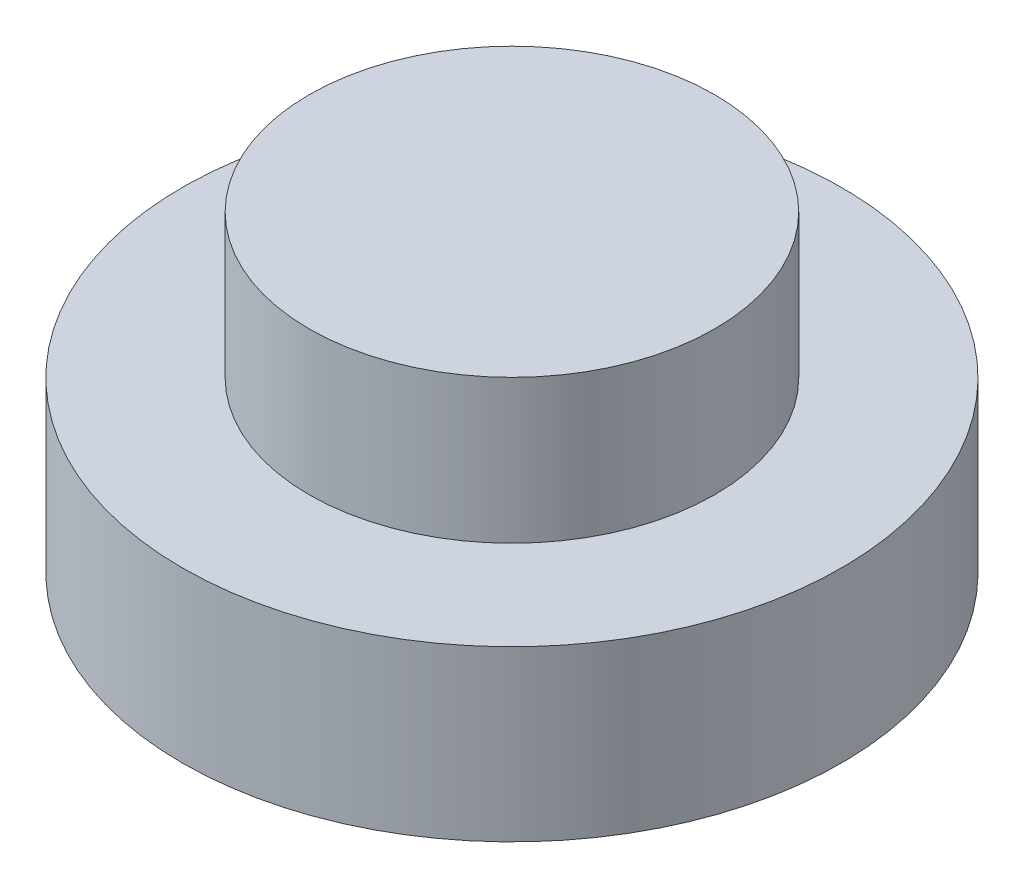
SolidWorks part; units mm, degrees
ref_plane "Front Plane" through (0, 0, 0) normal (0, 0, 1) x (1, 0, 0)
ref_plane "Top Plane" through (0, 0, 0) normal (0, 1, 0) x (1, 0, 0)
ref_plane "Right Plane" through (0, 0, 0) normal (1, 0, 0) x (0, 0, -1)
sketch "Sketch1" plane through (0, 0, 0) normal (0, 1, 0) x (1, 0, 0)
  circle A0 centre (0, 0) radius 3.9
  dimension "D1" = 7.8
extrude "Boss-Extrude1" add sketch "Sketch1" along normal blind 2
sketch "Sketch2" plane through (0, 2, 0) normal (0, 1, 0) x (1, 0, 0)
  circle A0 centre (0, 0) radius 2.4
  dimension "D1" = 4.8
extrude "Boss-Extrude2" add sketch "Sketch2" along normal blind 1.7
sketch "Sketch3" plane through (0, 0, 0) normal (0, -1, 0) x (1, 0, 0)
  circle A0 centre (0, 0) radius 2.4
  dimension "D1" = 4.8
extrude "Cut-Extrude1" cut sketch "Sketch3" against normal blind 1.7
